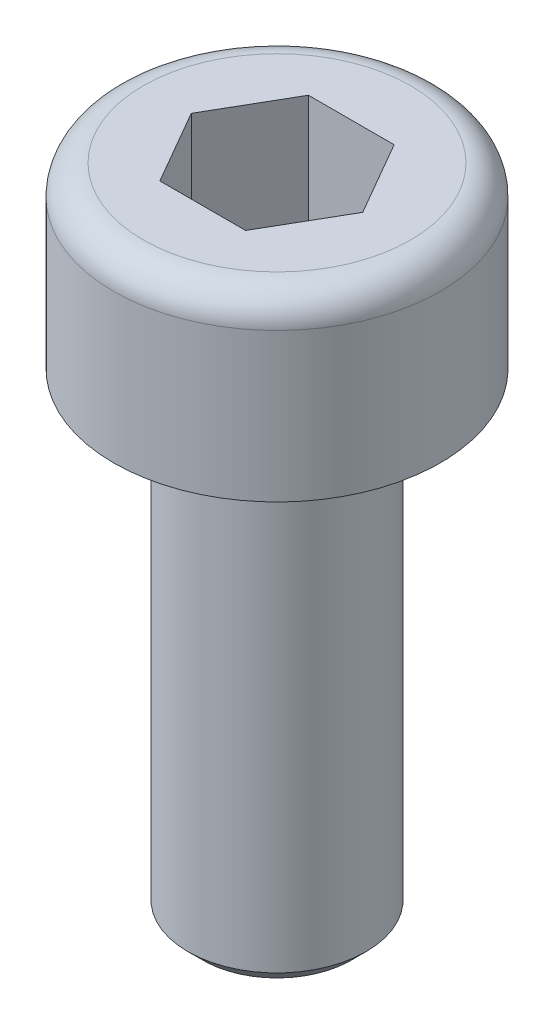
SolidWorks part; units mm, degrees
ref_plane "Plan1" through (0, 0, 0) normal (0, 0, 1) x (1, 0, 0)
ref_plane "Plan2" through (0, 0, 0) normal (0, 1, 0) x (1, 0, 0)
ref_plane "Plan3" through (0, 0, 0) normal (1, 0, 0) x (0, 0, -1)
sketch "Esquisse1" plane through (0, 0, 0) normal (0, 0, 1) x (1, 0, 0)
  line L0 (0, 20.9898) -> (0, -1.0346) construction
  line L1 (0, 11) -> (-2.25, 11)
  line L3 (-2.75, 10.5) -> (-2.75, 8)
  line L4 (-2.75, 8) -> (-1.5, 8)
  line L7 (-1.5, 8) -> (-1.5, 0)
  line L12 (-1.5, 0) -> (0, 0)
  line L13 (0, 11) -> (0, 0)
  arc A0 (-2.75, 10.5) -> (-2.25, 11) centre (-2.25, 10.5) cw
  dimension "D1" = 0.5
  dimension "D2" = 5.5
  dimension "D3" = 8
  dimension "D4" = 3
  dimension "D5" = 3
revolve "Base-Révolution" add sketch "Esquisse1" angle 360 about L0
sketch "Esquisse2" plane through (0, 11, 0) normal (0, 1, 0) x (-1, 0, 0)
  line L0 (0.7217, -1.25) -> (-0.7217, 1.25) construction
  line L1 (1.4434, 0) -> (-1.4434, 0) construction
  line L2 (-0.7217, -1.25) -> (0.7217, 1.25) construction
  line L3 (1.4434, 0) -> (0.7217, -1.25)
  line L4 (0.7217, -1.25) -> (-0.7217, -1.25)
  line L5 (-0.7217, -1.25) -> (-1.4434, 0)
  line L6 (-1.4434, 0) -> (-0.7217, 1.25)
  line L7 (-0.7217, 1.25) -> (0.7217, 1.25)
  line L8 (0.7217, 1.25) -> (1.4434, 0)
  dimension "D1" = 2.5
extrude "Enlèv. mat.-Extru.1" cut sketch "Esquisse2" against normal blind 2
chamfer "Chanfrein1" distance 0.25 angle 45
